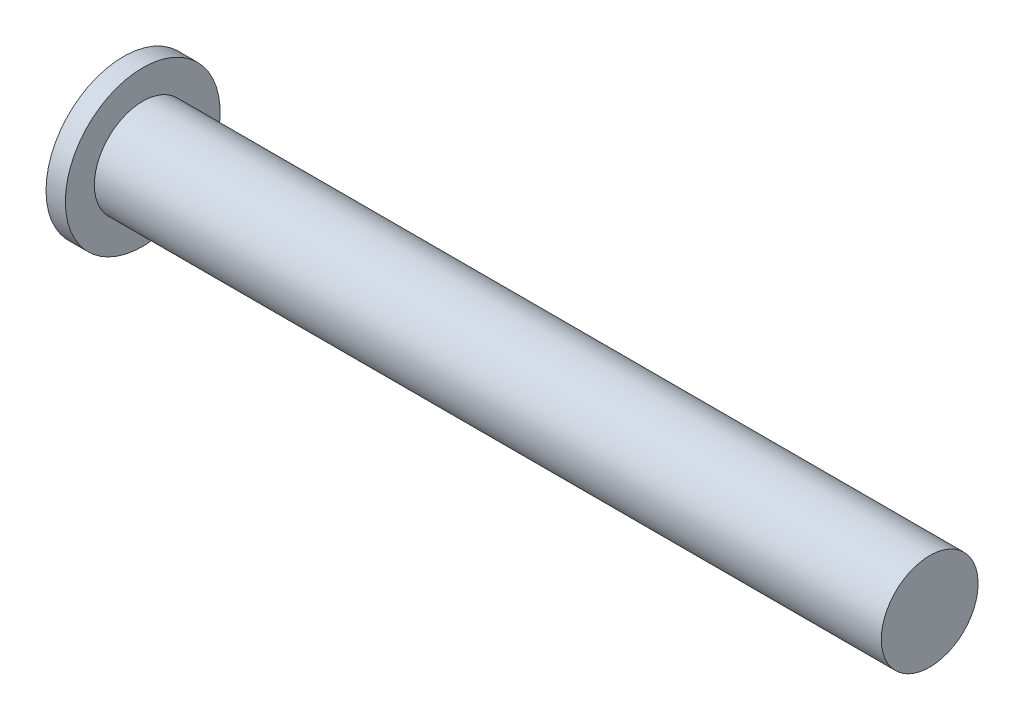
SolidWorks part; units mm, degrees
ref_plane "Front Plane" through (0, 0, 0) normal (0, 0, 1) x (1, 0, 0)
ref_plane "Top Plane" through (0, 0, 0) normal (0, 1, 0) x (1, 0, 0)
ref_plane "Right Plane" through (0, 0, 0) normal (1, 0, 0) x (0, 0, -1)
sketch "Sketch1" plane through (0, 0, 0) normal (0, 0, 1) x (1, 0, 0)
  line L0 (0, 0) -> (0, 4.8768)
  line L1 (0, 4.8768) -> (1.2192, 4.8768)
  line L2 (1.2192, 4.8768) -> (1.2192, 3.048)
  line L3 (1.2192, 3.048) -> (50.8, 3.048)
  line L4 (50.8, 3.048) -> (50.8, 0)
  line L5 (50.8, 0) -> (0, 0)
  line L6 (50.8, 0) -> (0, 0) construction
revolve "Revolve1" add sketch "Sketch1" angle 360 about L6
ref_plane "Plane1" through (50.8, 0, 0) normal (1, 0, 0) x (0, 0, -1)
